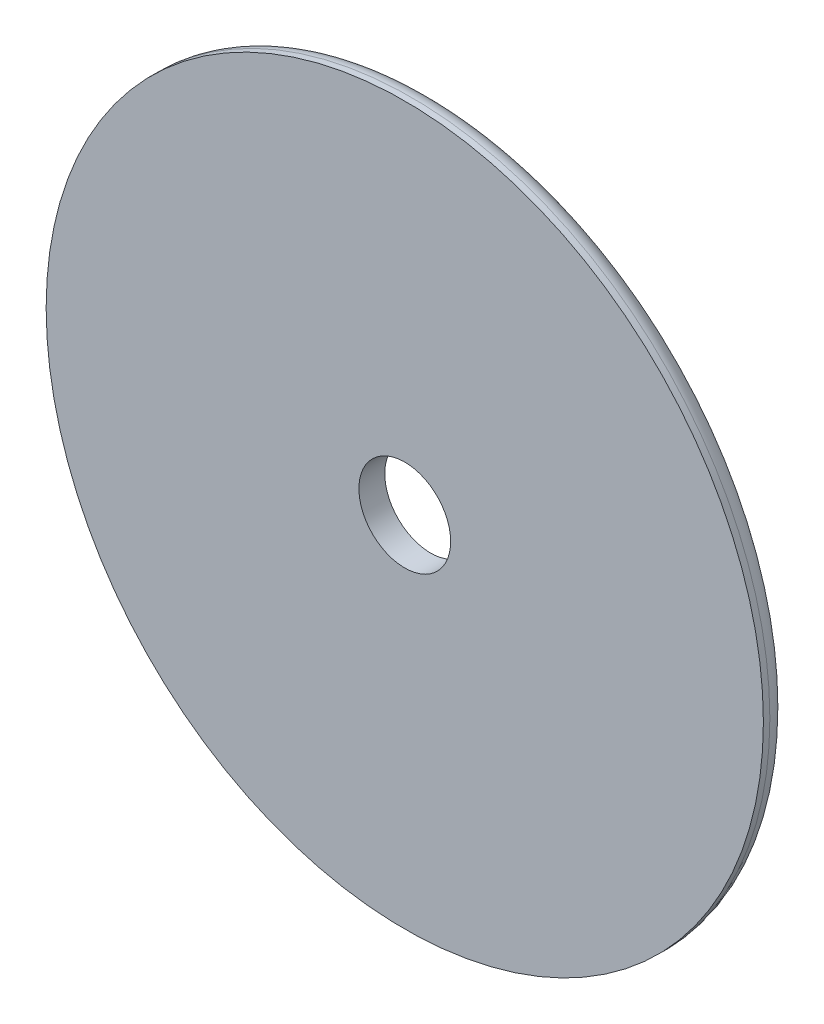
SolidWorks part; units mm, degrees
ref_plane "Face" through (0, 0, 0) normal (0, 0, 1) x (1, 0, 0)
ref_plane "Dessus" through (0, 0, 0) normal (0, 1, 0) x (1, 0, 0)
ref_plane "Côté" through (0, 0, 0) normal (1, 0, 0) x (0, 0, -1)
sketch "Esquisse1" plane through (0, 0, 0) normal (0, 0, 1) x (1, 0, 0)
  circle A0 centre (0, 0) radius 7.1
  circle A1 centre (0, 0) radius 55.5
  dimension "D1" = 14.2
  dimension "D2" = 111
extrude "Base-Extrusion" add sketch "Esquisse1" along normal blind 4
fillet "Congé1" radius 3
